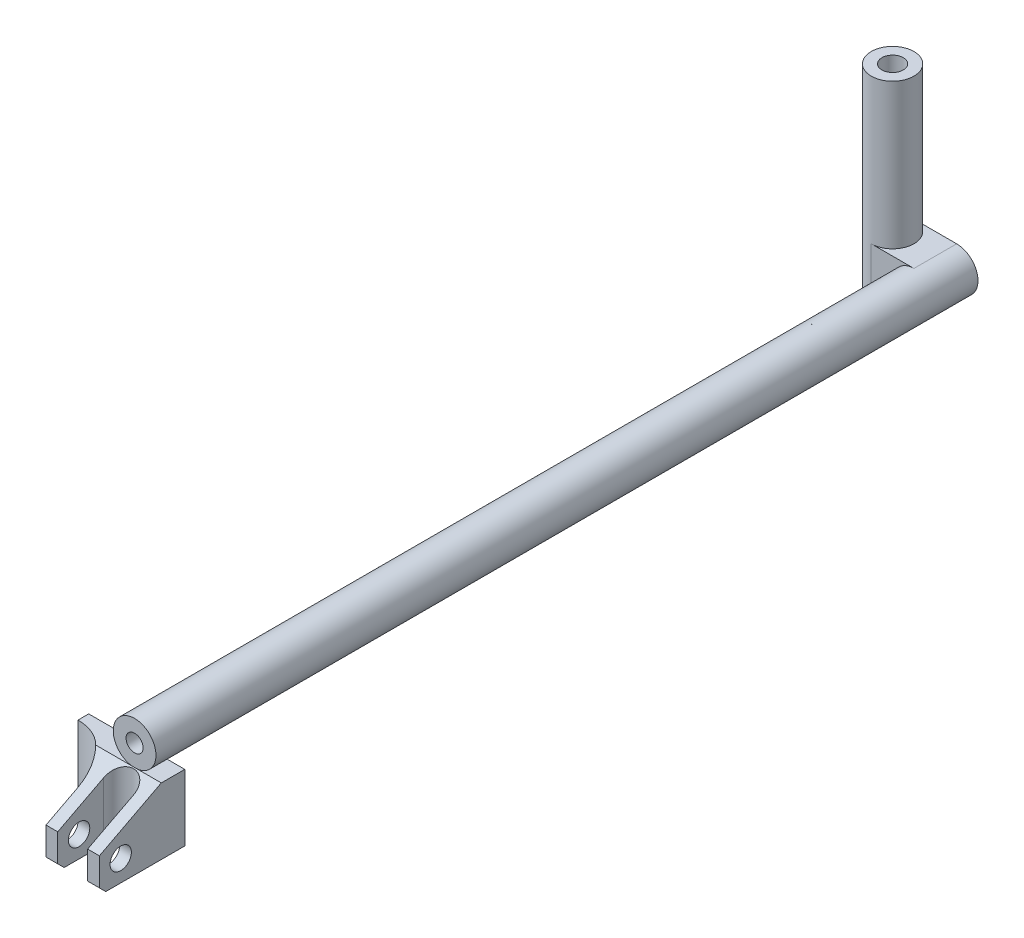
SolidWorks part; units mm, degrees
ref_plane "Plan de face" through (0, 0, 0) normal (0, 0, 1) x (1, 0, 0)
ref_plane "Plan de dessus" through (0, 0, 0) normal (0, 1, 0) x (1, 0, 0)
ref_plane "Plan de droite" through (0, 0, 0) normal (1, 0, 0) x (0, 0, -1)
mirrored part "bras telescopique gauche_Rendre symétrique"
other "<bras telescopique gauche>-<<bras telescopique>-<Extrusion7>>"
